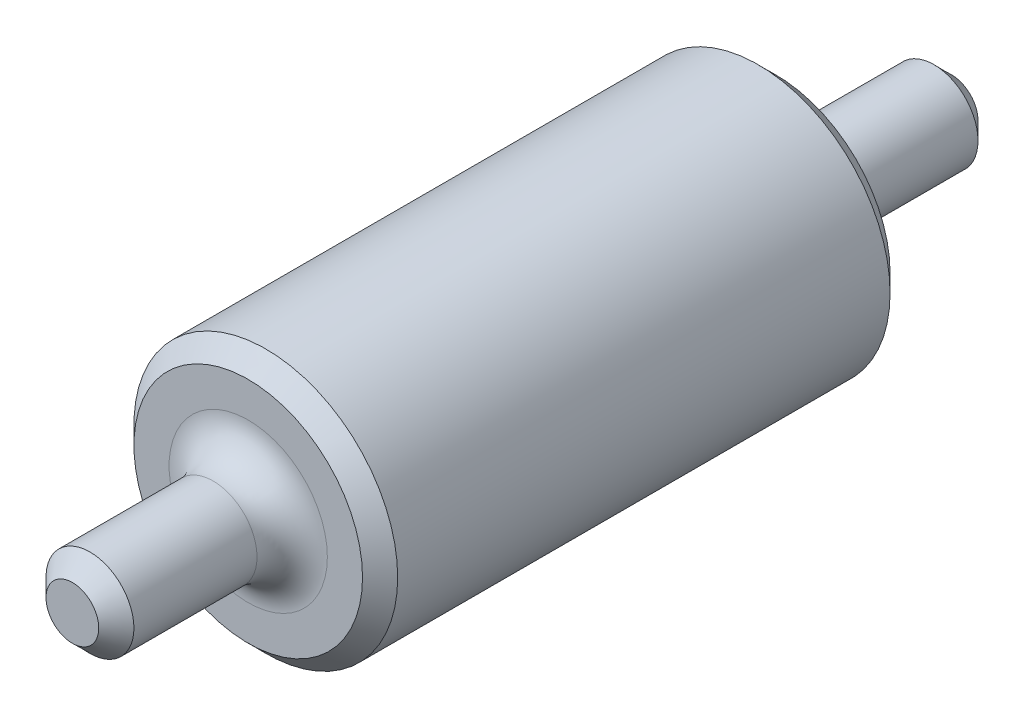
SolidWorks part; units mm, degrees
ref_plane "Front Plane" through (0, 0, 0) normal (0, 0, 1) x (1, 0, 0)
ref_plane "Top Plane" through (0, 0, 0) normal (0, 1, 0) x (1, 0, 0)
ref_plane "Right Plane" through (0, 0, 0) normal (1, 0, 0) x (0, 0, -1)
sketch "Esquisse1" plane through (0, 0, 0) normal (0, 0, 1) x (1, 0, 0)
  circle A0 centre (0, 0) radius 7.5
  dimension "D1" = 15
extrude "Boss.-Extru.1" add sketch "Esquisse1" along normal mid plane 30
sketch "Esquisse2" plane through (0, 0, 15) normal (0, 0, 1) x (1, 0, 0)
  circle A0 centre (0, 0) radius 2.5
  dimension "D1" = 5
extrude "Boss.-Extru.2" add sketch "Esquisse2" along normal blind 10
mirror "Symétrie1" about plane through (0, 0, 0) normal (0, 0, 1) of "Boss.-Extru.2"
chamfer "Chanfrein1" distance 1 angle 45 4 edges at (7.5, 0, -15) (7.5, 0, 15) (2.5, 0, -25) (2.5, 0, 25)
fillet "Congé1" radius 2 2 edges at (2.5, 0, -15) (2.5, 0, 15)
